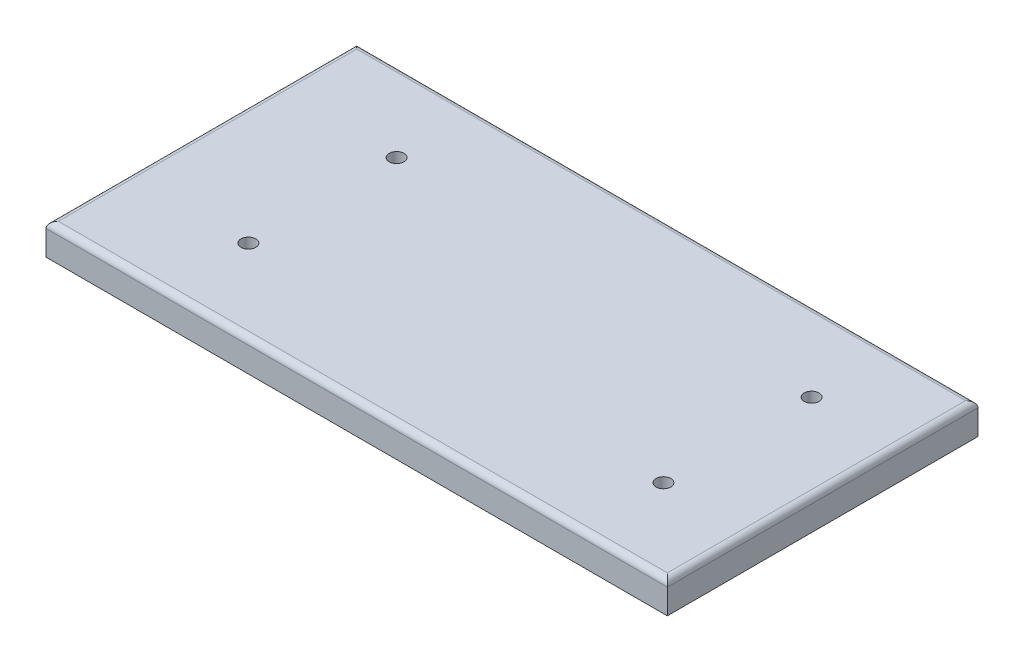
SolidWorks part; units mm, degrees
ref_plane "Front Plane" through (0, 0, 0) normal (0, 0, 1) x (1, 0, 0)
ref_plane "Top Plane" through (0, 0, 0) normal (0, 1, 0) x (1, 0, 0)
ref_plane "Right Plane" through (0, 0, 0) normal (1, 0, 0) x (0, 0, -1)
sketch "Sketch1"
  dimension "D1" = 254
  dimension "D2" = 127
extrude "Extrude1" add sketch "Sketch1" along normal blind 12.7
fillet "Fillet1" radius 2.54 4 edges at (-127, 12.7, 0) (0, 12.7, -63.5) (-127, 12.7, -127) (-254, 12.7, -63.5)
hole_wizard "B (0.238) Diameter Hole1" positions "3DSketch1" profile "Sketch3" hole size "B" standard "Ansi Inch"
sketch3d "3DSketch1"
  dimension "D1" = 60.579
  dimension "D2" = 169.672
sketch "Sketch3"
  dimension "Hole Dia." = 6.0452
  dimension "Hole Depth" = 25.4
  dimension "Drill Angle" = 118
